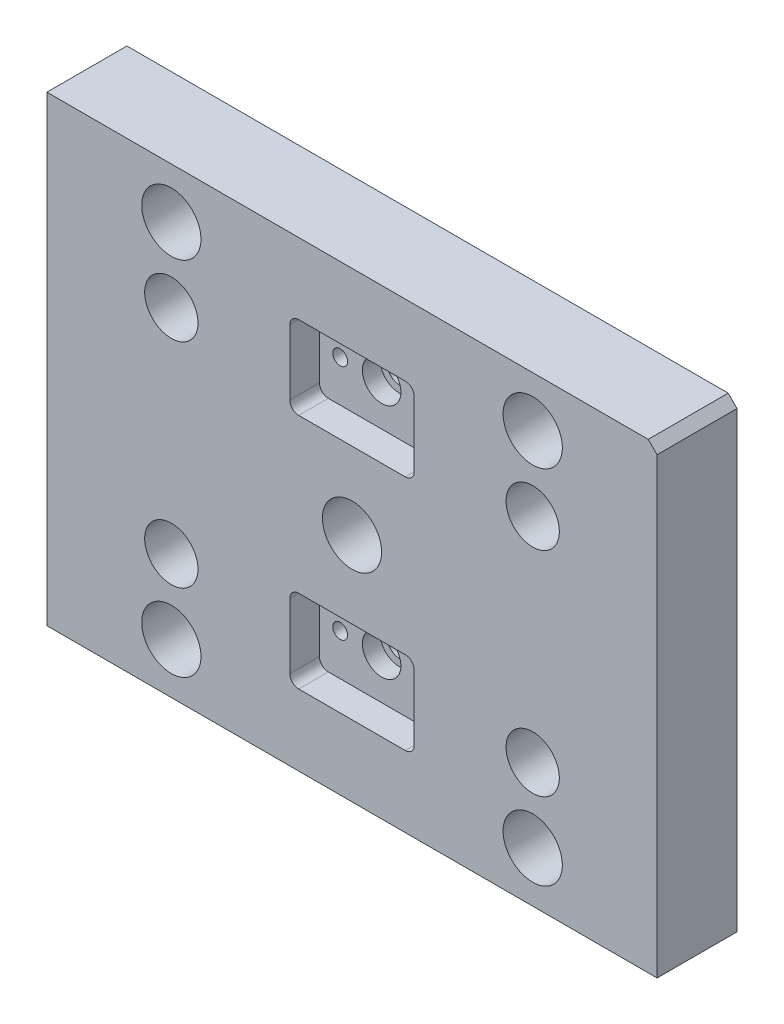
SolidWorks part; units mm, degrees
ref_plane "Plan de face" through (0, 0, 0) normal (0, 0, 1) x (1, 0, 0)
ref_plane "Plan de dessus" through (0, 0, 0) normal (0, 1, 0) x (1, 0, 0)
ref_plane "Plan de droite" through (0, 0, 0) normal (1, 0, 0) x (0, 0, -1)
sketch "Esquisse1" plane through (0, 0, 0) normal (0, 0, 1) x (1, 0, 0)
  line L1 (-103, 78) -> (103, 78)
  line L2 (-103, 78) -> (-103, -78)
  line L3 (-103, -78) -> (103, -78)
  line L4 (103, 78) -> (103, -78)
  point P4 (0, 78)
  point P7 (-103, 0)
  dimension "D1" = 206
  dimension "D2" = 156
extrude "Extrusion1" add sketch "Esquisse1" along normal blind 27
sketch "Esquisse3" plane through (0, 0, 27) normal (0, 0, 1) x (1, 0, 0)
  circle A0 centre (-61, 61) radius 10
  circle A1 centre (-61, 36) radius 5.25
  dimension "D1" = 61
  dimension "D2" = 61
  dimension "D3" = 20
  dimension "D4" = 61
  dimension "D5" = 36
  dimension "D6" = 10.5
extrude "Enlèv. mat.-Extru.1" cut sketch "Esquisse3" against normal through all
sketch "Esquisse13" plane through (0, 0, 27) normal (0, 0, 1) x (1, 0, 0)
  circle A0 centre (-61, 36) radius 9
  dimension "D1" = 18
extrude "Enlèv. mat.-Extru.9" cut sketch "Esquisse13" against normal blind 13
mirror "Symétrie1" about plane through (0, 0, 0) normal (1, 0, 0) of "Enlèv. mat.-Extru.9", "Enlèv. mat.-Extru.1"
mirror "Symétrie2" about plane through (0, 0, 0) normal (0, 1, 0) of "Symétrie1", "Enlèv. mat.-Extru.1", "Enlèv. mat.-Extru.9"
sketch "Esquisse5" plane through (0, 0, 27) normal (0, 0, 1) x (1, 0, 0)
  line L0 (-17.5, 0) -> (-17.5, -24)
  line L1 (17.5, 0) -> (17.5, -24)
  arc A0 (17.5, 0) -> (-17.5, 0) centre (0, 0) ccw
  arc A1 (-17.5, -24) -> (17.5, -24) centre (0, -24) ccw
  dimension "D1" = 17.5
  dimension "D3" = 24
extrude "Passage attelage" [suppressed] cut sketch "Esquisse5" against normal blind 21
sketch "Esquisse8" [suppressed] plane through (0, 0, 6) normal (0, 0, 1) x (1, 0, 0)
  circle A0 centre (0, 0) radius 8
  dimension "D1" = 16
extrude "Enlèv. mat.-Extru.5" [suppressed] cut sketch "Esquisse8" against normal through all
sketch "Esquisse10" plane through (0, 0, 27) normal (0, 0, 1) x (1, 0, 0)
  line L0 (-21, -40) -> (21, -40) construction
  line L1 (-21, -26) -> (21, -26)
  line L2 (-21, -26) -> (-21, -54)
  line L3 (-21, -54) -> (21, -54)
  line L4 (21, -26) -> (21, -54)
  line L5 (0, -26) -> (0, -54) construction
  dimension "D1" = 28
  dimension "D2" = 40
  dimension "D3" = 42
extrude "Enlèv. mat.-Extru.6" cut sketch "Esquisse10" against normal blind 10
fillet "Congé1" radius 3 4 edges at (-21, -54, 22) (21, -54, 22) (21, -26, 22) (-21, -26, 22)
sketch "Esquisse17" plane through (0, 0, 27) normal (0, 0, 1) x (1, 0, 0)
  circle A0 centre (0, 0) radius 10
  dimension "D1" = 20
extrude "Enlèv. mat.-Extru.12" cut sketch "Esquisse17" against normal through all
chamfer "Chanfrein_D" distance 3 angle 45 1 edges at (103, 78, 13.5)
mirror "Symétrie3" about plane through (0, 0, 0) normal (0, 1, 0) of "Enlèv. mat.-Extru.6", "Congé1"
sketch "Esquisse18" plane through (0, 0, 0) normal (0, 0, -1) x (-1, 0, 0)
  line L0 (0, 0) -> (0, -87.6031) construction
  circle A0 centre (0, -40) radius 4.1
  circle A1 centre (0, 40) radius 4.1
  dimension "D2" = 8.2
  dimension "D3" = 40
  dimension "D4" = 40
extrude "Enlèv. mat.-Extru.13" cut sketch "Esquisse18" against normal through all
sketch "Esquisse19" plane through (0, 0, 17) normal (0, 0, 1) x (1, 0, 0)
  circle A0 centre (0, 40) radius 6.5
  circle A1 centre (0, -40) radius 6.5
  dimension "D1" = 13
extrude "Enlèv. mat.-Extru.14" cut sketch "Esquisse19" against normal blind 6
hole_wizard "Trou taraudé M61" positions "Esquisse22" profile "Esquisse21" tap size "M6" standard "ISO"
sketch "Esquisse22" plane through (0, 0, 17) normal (0, 0, 1) x (1, 0, 0)
  line L0 (-6.5, 40) -> (6.5, 40) construction
  line L2 (0, 40) -> (0, 54) construction
  line L3 (-18, 54) -> (18, 54) construction
  circle A0 centre (0, 40) radius 6.5 construction
  point P0 (14, 40)
  point P1 (-14, 40)
  dimension "D1" = 14
  dimension "D2" = 14
sketch "Esquisse21" plane through (14, 40, 17) normal (1, 0, 0) x (0, -1, 0)
  line L0 (0, 0) -> (0, 18.5022)
  line L1 (0, 18.5022) -> (2.5, 17)
  line L2 (2.5, 17) -> (2.5, 0)
  line L5 (2.5, 0) -> (0, 0)
  line L10 (0, 18.5022) -> (-2.5, 17) construction
  line L11 (0, -6.35) -> (0, 107.95) construction
  dimension "Diamètre du trou pour taraudage" = 5
  dimension "Profondeur du trou pour taraudage" = 17
  dimension "Angle de pointe" = 118
mirror "Symétrie4" about plane through (0, 0, 0) normal (0, 1, 0) of "Trou taraudé M61"
